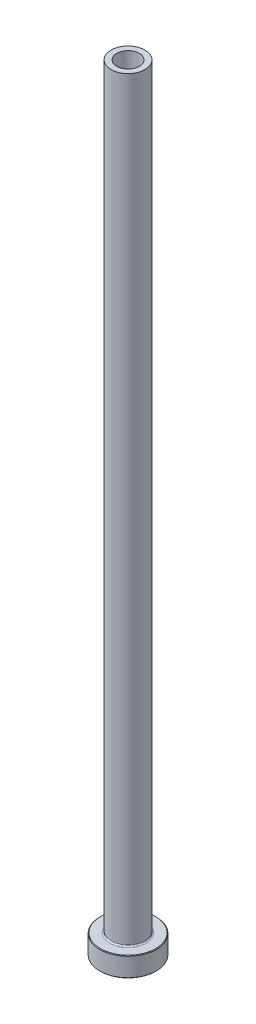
SolidWorks part; units mm, degrees
ref_plane "Front Plane" through (0, 0, 0) normal (0, 0, 1) x (1, 0, 0)
ref_plane "Top Plane" through (0, 0, 0) normal (0, 1, 0) x (1, 0, 0)
ref_plane "Right Plane" through (0, 0, 0) normal (1, 0, 0) x (0, 0, -1)
sketch "Sketch1" plane through (0, 0, 0) normal (0, 0, 1) x (1, 0, 0)
  line L0 (-4, 275) -> (-6, 275)
  line L1 (-6, 275) -> (-6, 7)
  line L2 (-6, 7) -> (-10, 7)
  line L3 (-10, 7) -> (-10, 0)
  line L4 (11, 0) -> (-11, 0) construction
  line L5 (-10, 0) -> (-4.25, 0)
  line L6 (-4, 230) -> (-4, 275)
  line L7 (0, 92.1877) -> (0, -15.5353) construction
  line L8 (0, -11) -> (0, 11) construction
  line L9 (-4, 230) -> (-4.25, 218)
  line L10 (-4.25, 218) -> (-4.25, 0)
  dimension "D1" = 0.25
  dimension "ID" = 8
  dimension "OD" = 12
  dimension "L" = 275
  dimension "H" = 20
  dimension "T" = 7
  dimension "N" = 45
  dimension "D2" = 12
revolve "Revolve1" add sketch "Sketch1" angle 360 about L7
fillet "Fillet1" radius 0.5 1 edges at (0, 7, 6)
chamfer "Chamfer1" distance 0.2 angle 45 2 edges at (0, 7, 10) (0, 0, 10)
chamfer "Chamfer3" distance 0.5 angle 45 1 edges at (0, 0, 4.25)
